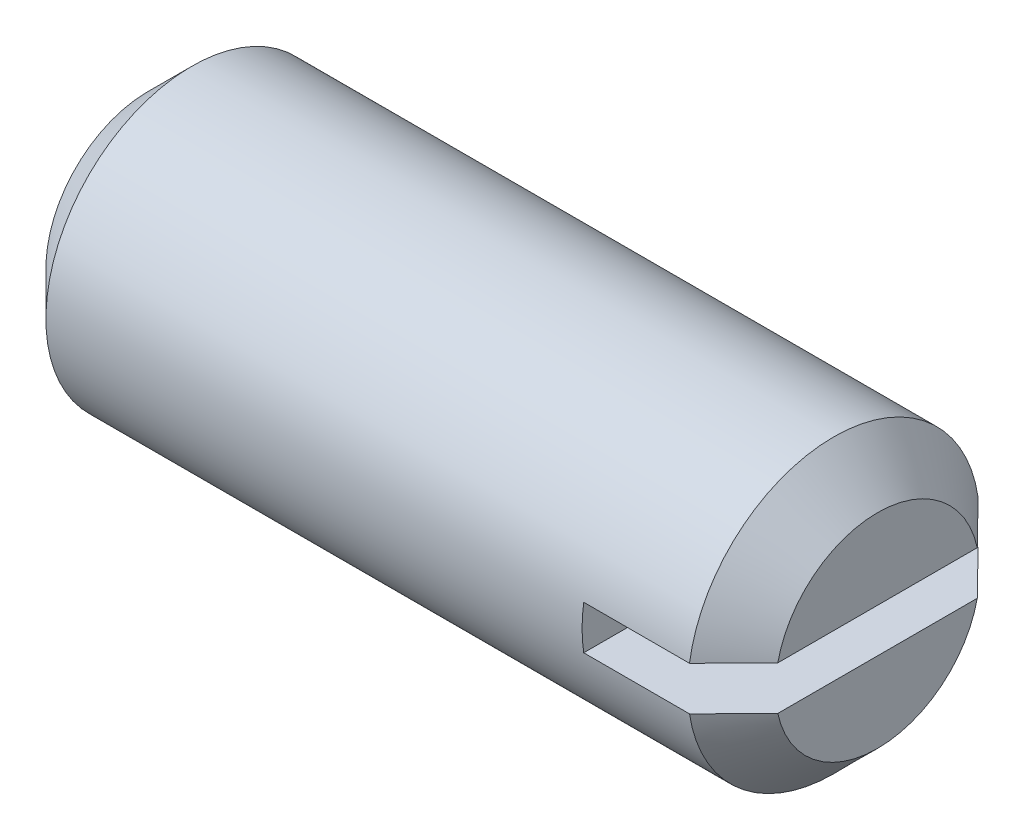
SolidWorks part; units mm, degrees
ref_plane "Front" through (0, 0, 0) normal (0, 0, 1) x (1, 0, 0)
ref_plane "Top" through (0, 0, 0) normal (0, 1, 0) x (1, 0, 0)
ref_plane "Right" through (0, 0, 0) normal (1, 0, 0) x (0, 0, -1)
other "Configuration Table"
sketch "Sketch1" plane through (0, 0, 0) normal (1, 0, 0) x (0, 0, -1)
  circle A0 centre (0, 0) radius 2
extrude "Body" add sketch "Sketch1" along normal blind 10
chamfer "Chamfer1" distance 0.6 angle 45 2 edges at (10, 0, -2) (0, 0, -2)
sketch "Sketch2" plane through (-1.025, -1.025, 0) normal (0, 0, 1) x (0, 1, 0)
  line L1 (0.725, -8.975) -> (1.325, -8.975)
  line L2 (0.725, -8.975) -> (0.725, -11.025)
  line L3 (0.725, -11.025) -> (1.325, -11.025)
  line L4 (1.325, -8.975) -> (1.325, -11.025)
  line L5 (-0.375, -11.025) -> (2.425, -11.025) construction
extrude "Split" cut sketch "Sketch2" against normal through all and the other way through all
sketch "Sketch3" plane through (0, 0, 0) normal (0, 0, 1) x (1, 0, 0)
  line L0 (0, 0) -> (10.1592, 0) construction
  line L1 (4.225, 2.35) -> (4.575, 2.35)
  line L2 (4.575, 2.35) -> (4.575, 2)
  line L3 (4.575, 2) -> (4.4, 1.6969)
  line L4 (4.4, 1.6969) -> (4.225, 2)
  line L5 (4.225, 2) -> (4.225, 2.35)
  line L6 (0, 1.4) -> (0, -1.4) construction
revolve "Cut-Revolve10" [suppressed] cut sketch "Sketch3" angle 360 about L0
pattern_linear "LPattern10" [suppressed] count 10 spacing 0.42
equation "\"n/2@Sketch2\" = \"n@Sketch2\" / 2"
equation "\"D1@Sketch3\" = \"d@Sketch1\""
equation "\"D2@Sketch3\" =  ( \"d@Sketch1\" - \"D2@ThreadCosmetic1\" )  / 2"
equation "\"D3@Sketch3\" = \"b@ThreadCosmetic1\""
equation "\"D3@LPattern10\" = \"D2@Sketch3\" * 1.2"
equation "\"D1@LPattern10\" = \"b@ThreadCosmetic1\" / \"D3@LPattern10\""
